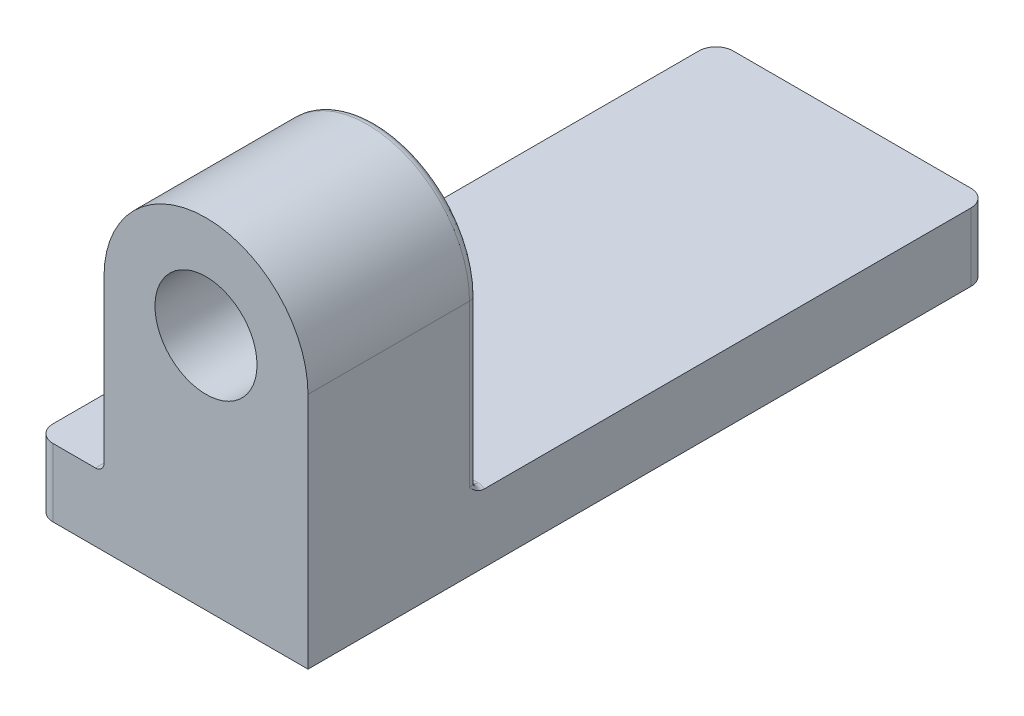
SolidWorks part; units mm, degrees
ref_plane "Front" through (0, 0, 0) normal (0, 0, 1) x (1, 0, 0)
ref_plane "Top" through (0, 0, 0) normal (0, 1, 0) x (1, 0, 0)
ref_plane "Right" through (0, 0, 0) normal (1, 0, 0) x (0, 0, -1)
sketch "Sketch1" plane through (0, 0, 0) normal (0, 0, 1) x (1, 0, 0)
  line L0 (0, 0) -> (50.8, 0)
  line L1 (0, 0) -> (0, 12.7)
  line L2 (50.8, 12.7) -> (0, 12.7)
  line L3 (50.8, 12.7) -> (50.8, 0)
  dimension "D1" = 50.8
  dimension "D2" = 12.7
extrude "Base-Extrude" add sketch "Sketch1" along normal blind 127
sketch "Sketch2" plane through (0, 0, 127) normal (0, 0, 1) x (1, 0, 0)
  line L0 (12.7, 12.7) -> (12.7, 44.45)
  line L1 (50.8, 44.45) -> (50.8, 12.7)
  line L2 (50.8, 12.7) -> (0, 12.7) construction
  line L3 (50.8, 12.7) -> (12.7, 12.7)
  line L4 (50.8, 12.7) -> (50.8, 0) construction
  arc A0 (12.7, 44.45) -> (50.8, 44.45) centre (31.75, 44.45) cw
  dimension "D1" = 38.1
  dimension "D2" = 50.8
extrude "Boss-Extrude1" add sketch "Sketch2" against normal blind 31.75
sketch "Sketch3" plane through (0, 0, 127) normal (0, 0, 1) x (1, 0, 0)
  circle A0 centre (31.75, 44.45) radius 9.525
  dimension "D1" = 19.05
extrude "Cut-Extrude1" cut sketch "Sketch3" against normal through all
fillet "Fillet1" radius 3.175 3 edges at (0, 6.35, 127) (50.8, 6.35, 0) (0, 6.35, 0)
fillet "Fillet2" radius 1.5875 5 edges at (12.7, 28.575, 95.25) (31.75, 63.5, 95.25)
fillet "Fillet3" radius 1.5875 7 edges at (13.165, 12.7, 95.715) (50.335, 12.7, 95.715)
